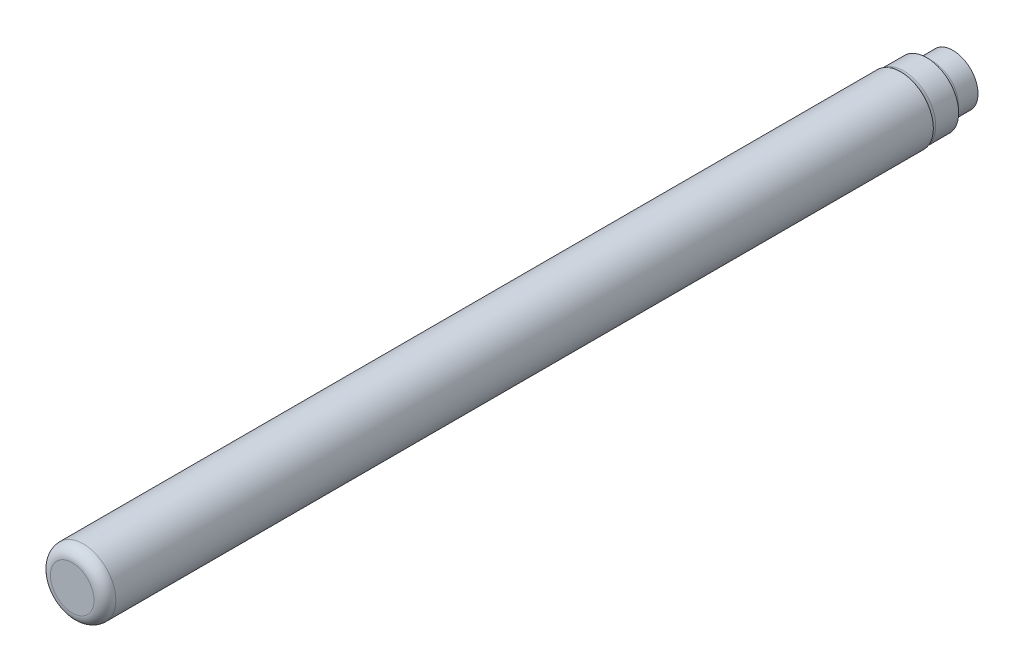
SolidWorks part; units mm, degrees
ref_plane "Front" through (0, 0, 0) normal (0, 0, 1) x (1, 0, 0)
ref_plane "Top" through (0, 0, 0) normal (0, 1, 0) x (1, 0, 0)
ref_plane "Right" through (0, 0, 0) normal (1, 0, 0) x (0, 0, -1)
sketch "Esquisse1" plane through (0, 0, 0) normal (0, 0, 1) x (1, 0, 0)
  circle A0 centre (0, 0) radius 7.5
  dimension "D1" = 15
extrude "Boss.-Extru.1" add sketch "Esquisse1" along normal blind 190
sketch "Esquisse2" plane through (0, 0, 0) normal (0, 0, -1) x (-1, 0, 0)
  circle A0 centre (0, 0) radius 7.3
  dimension "D1" = 14.6
extrude "Boss.-Extru.2" add sketch "Esquisse2" along normal blind 6
sketch "Esquisse3" plane through (0, 0, -6) normal (0, 0, -1) x (-1, 0, 0)
  circle A0 centre (0, 0) radius 5.75
  dimension "D1" = 11.5
extrude "Boss.-Extru.3" add sketch "Esquisse3" along normal blind 6
fillet "Congé1" radius 2.5 1 edges at (7.5, 0, 190)
fillet "Congé2" radius 1.5 2 edges at (-5.75, 0, -6) (7.3, 0, 0)
sketch "Esquisse4" plane through (0, 0, 0) normal (1, 0, 0) x (0, 0, -1)
  line L0 (3.2, 5.7733) -> (-2.8, 5.7733) construction
  line L1 (3.2, 5.7733) -> (-187.5, 5.7733)
  line L3 (3.2, 5.7733) -> (5, 5.5424)
  line L8 (6, 5.5424) -> (5, 5.5424) construction
  line L9 (6, 5.5424) -> (5, 5.5424)
  line L10 (7.5, 4.1568) -> (6, 5.5424) construction
  line L11 (7.5, 4.1568) -> (6, 5.5424)
  line L12 (12, 4.1568) -> (7.5, 4.1568) construction
  line L13 (12, 4.1568) -> (7.5, 4.1568)
  line L14 (-187.5, -7.5) -> (-187.5, 7.5) construction
  line L15 (-187.5, 0) -> (-187.5, 5.7733)
  line L16 (12, 0) -> (-11.0549, 0) construction
  line L17 (12, 0) -> (-187.5, 0)
  line L18 (12, 4.1568) -> (12, 0)
  line L19 (0, 0) -> (12, 0) construction
revolve "Enlèvement de matière-Révolution1" cut sketch "Esquisse4" angle 360 about L19
